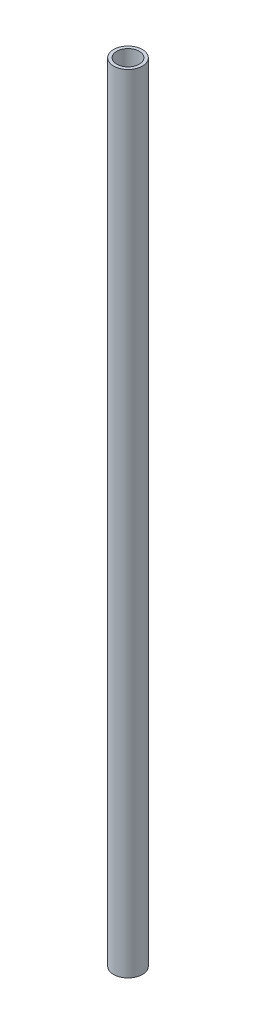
SolidWorks part; units mm, degrees
ref_plane "Front Plane" through (0, 0, 0) normal (0, 0, 1) x (1, 0, 0)
ref_plane "Top Plane" through (0, 0, 0) normal (0, 1, 0) x (1, 0, 0)
ref_plane "Right Plane" through (0, 0, 0) normal (1, 0, 0) x (0, 0, -1)
sketch "Sketch1" plane through (0, 0, 0) normal (0, 1, 0) x (1, 0, 0)
  circle A0 centre (0, 0) radius 13.0683
  circle A1 centre (0, 0) radius 16.7005
  dimension "D1" = 33.401
  dimension "D2" = 26.1366
extrude "Boss-Extrude1" add sketch "Sketch1" along normal blind 914.4
